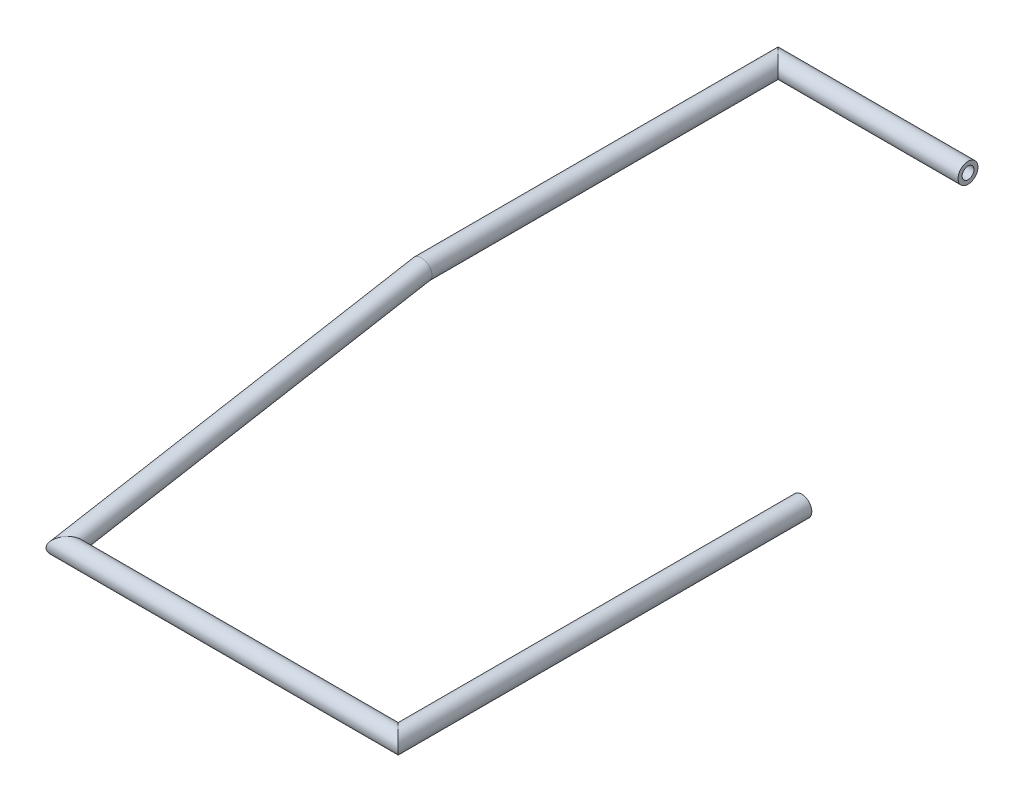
SolidWorks part; units mm, degrees
ref_plane "Front Plane" through (0, 0, 0) normal (0, 0, 1) x (1, 0, 0)
ref_plane "Top Plane" through (0, 0, 0) normal (0, 1, 0) x (1, 0, 0)
ref_plane "Right Plane" through (0, 0, 0) normal (1, 0, 0) x (0, 0, -1)
sketch "Sketch2" plane through (0, 2165.865, 0) normal (0, 1, 0) x (1, 0, 0)
  line L0 (0, 0) -> (0, -431.8)
  line L1 (0, -431.8) -> (-355.6, -431.8)
  line L2 (-355.6, -431.8) -> (-355.6, 330.2)
  line L3 (-355.6, 330.2) -> (-152.4, 330.2)
  dimension "D1" = 762
  dimension "D2" = 355.6
  dimension "D3" = 431.8
  dimension "D4" = 203.2
sketch "Sketch3" plane through (0, 0, 0) normal (0, 0, 1) x (1, 0, 0)
  circle A0 centre (0, 2165.865) radius 6.35
  circle A1 centre (0, 2165.865) radius 10.668
  dimension "D1" = 21.336
  dimension "D2" = 12.7
sketch3d "3DSketch1"
  line L0 (0, 2165.865, 0) -> (0, 2165.865, 431.8)
  line L1 (0, 2165.865, 431.8) -> (-355.6, 2165.865, 431.8)
  line L2 (-355.6, 2165.865, 431.8) -> (-355.6, 2233.0456, 50.8)
  line L3 (-355.6, 2233.0456, 50.8) -> (-355.6, 2233.0456, -330.2)
  line L4 (-355.6, 2233.0456, -330.2) -> (-152.4, 2233.0456, -330.2)
  line L5 (-355.6, 2233.0456, 50.8) -> (-355.6, 2165.865, 50.8) construction
  line L6 (-355.6, 2165.865, 431.8) -> (-355.6, 2165.865, -330.2) construction
  line L7 (-355.6, 2233.0456, -330.2) -> (-355.6, 2165.865, -330.2) construction
  line L8 (-152.4, 2233.0456, -330.2) -> (-152.4, 2165.865, -330.2) construction
  dimension "D1" = 381
  dimension "D2" = 10
sweep "Sweep1" add profiles "Sketch3" path "3DSketch1"
